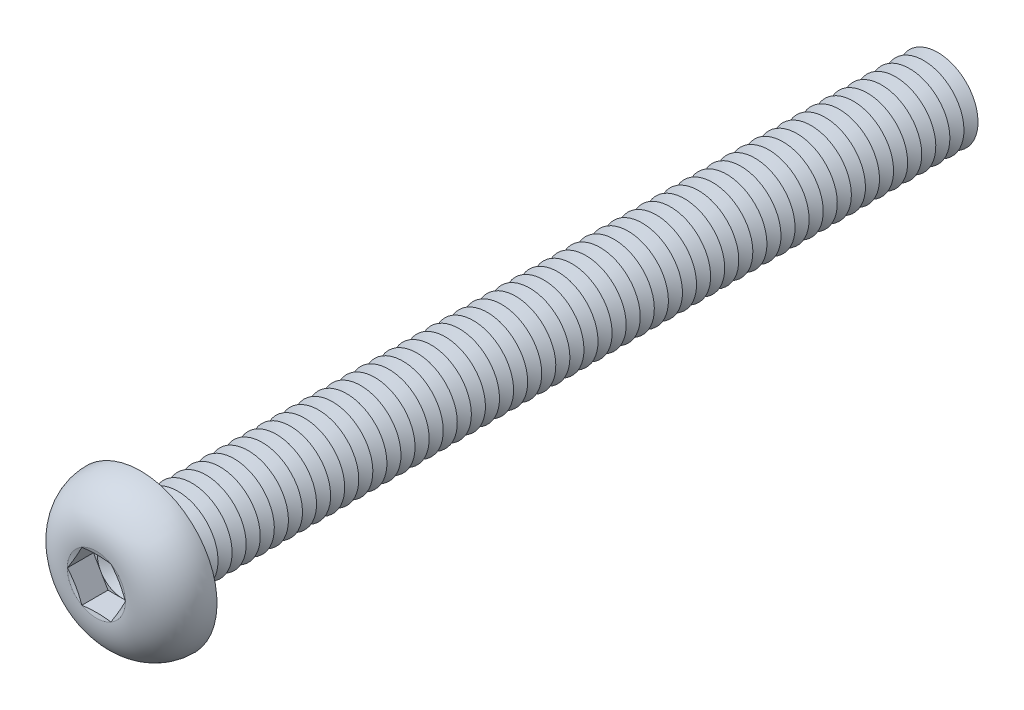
SolidWorks part; units mm, degrees
ref_plane "Front Plane" through (0, 0, 0) normal (0, 0, 1) x (1, 0, 0)
ref_plane "Top Plane" through (0, 0, 0) normal (0, 1, 0) x (1, 0, 0)
ref_plane "Right Plane" through (0, 0, 0) normal (1, 0, 0) x (0, 0, -1)
sketch "Sketch1" plane through (0, 0, 0) normal (1, 0, 0) x (0, 0, -1)
  line L0 (0, 2) -> (0, 3.8)
  line L3 (0, 2) -> (40, 2)
  line L4 (40, 2) -> (40, 0)
  line L5 (40, 0) -> (-2.2, 0) construction
  line L6 (-2.2, 0) -> (40, 0)
  line L7 (-2.2, 1.4434) -> (-2.2, 0.7217) construction
  line L8 (-2.2, 0.7217) -> (-2.2, 0)
  line L9 (-2.2, 1.4434) -> (-2.0066, 0.7217)
  line L10 (-2.0066, 0.7217) -> (-2.2, 0.7217)
  line L11 (40, 0) -> (22.7481, 0) construction
  line L12 (0, 3.8) -> (-2.2, 3.8) construction
  arc A1 (0, 3.8) -> (-2.2, 1.4434) centre (0, 1.5948) ccw
  point P8 (40, 1)
  dimension "D1" = 7.6
  dimension "D2" = 4
  dimension "D3" = 2.2
  dimension "D4" = 2.8868
  dimension "D5" = 40
  dimension "D6" = 15
revolve "Revolve1" add sketch "Sketch1" angle 360 about L5
fillet "Fillet1" radius 0.35 1 edges at (0, 2, 0)
sketch "Sketch2" plane through (0, 0, 0) normal (1, 0, 0) x (0, 0, -1)
  line L0 (39.65, 2) -> (40.35, 2)
  line L1 (40, 2) -> (0.35, 2) construction
  line L2 (40.35, 2) -> (40, 1.3938)
  line L3 (40, -2) -> (40, 2) construction
  line L4 (40, 1.3938) -> (39.65, 2)
  dimension "D1" = 0.7
revolve "Cut-Revolve1" cut sketch "Sketch2" angle 360 about axis through (0, 0, -40) along (0, 0, -1)
pattern_linear "LPattern1" count 57 spacing 0.7 along (0, 0, 1) of "Cut-Revolve1"
sketch "Sketch3" plane through (0, 0, 2.2) normal (0, 0, 1) x (1, 0, 0)
  line L7 (0.7217, 1.25) -> (-0.7217, 1.25)
  line L8 (-0.7217, 1.25) -> (-1.4434, 0)
  line L9 (-1.4434, 0) -> (-0.7217, -1.25)
  line L10 (-0.7217, -1.25) -> (0.7217, -1.25)
  line L11 (0.7217, -1.25) -> (1.4434, 0)
  line L12 (1.4434, 0) -> (0.7217, 1.25)
  circle A0 centre (0, 0) radius 1.25 construction
  circle A3 centre (0, 0) radius 1.4434 construction
extrude "Cut-Extrude1" cut sketch "Sketch3" against normal blind 1.3
sketch "Sketch4" plane through (0, 0, 0.9) normal (0, 0, 1) x (1, 0, 0)
  line L1 (0.7217, 1.25) -> (-0.7217, 1.25) construction
  circle A0 centre (0, 0) radius 1.25
extrude "Cut-Extrude2" cut sketch "Sketch4" against normal through all draft 60
